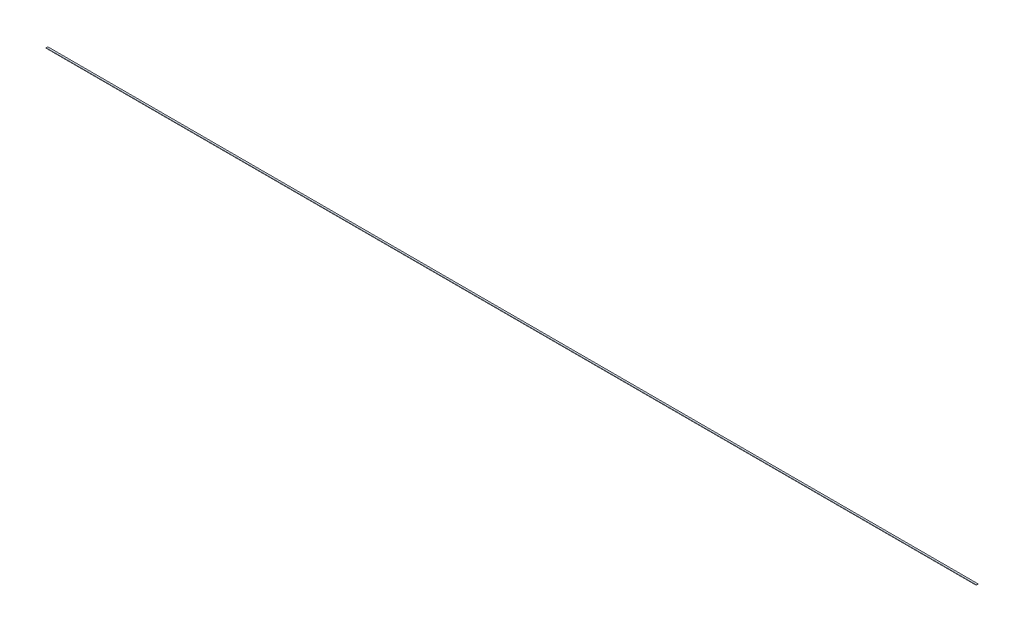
SolidWorks part; units mm, degrees
ref_plane "Plan de face" through (0, 0, 0) normal (0, 0, 1) x (1, 0, 0)
ref_plane "Plan de dessus" through (0, 0, 0) normal (0, 1, 0) x (1, 0, 0)
ref_plane "Plan de droite" through (0, 0, 0) normal (1, 0, 0) x (0, 0, -1)
sketch "Esquisse1" plane through (0, 0, 0) normal (0, 0, 1) x (1, 0, 0)
  line L0 (-13898.9434, 5058.8017) -> (0, 0) construction
  line L1 (496101.0566, 5058.8017) -> (-13898.9434, 5058.8017)
  line L2 (496101.0566, 5058.8017) -> (496101.0566, 5258.8017)
  line L3 (496101.0566, 5258.8017) -> (-13898.9434, 5258.8017)
  line L6 (-13898.9434, 5258.8017) -> (-13898.9434, 5058.8017)
  point P0 (0, 0)
  dimension "D1" = 510000
  dimension "D2" = 200
  dimension "D5" = 20
extrude "Boss.-Extru.1" add sketch "Esquisse1" along normal blind 1000
